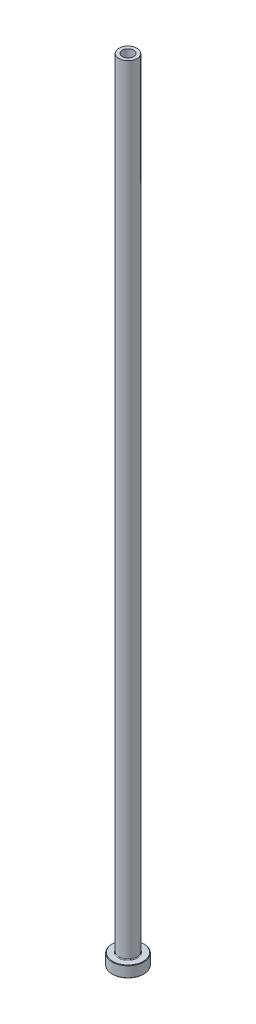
SolidWorks part; units mm, degrees
ref_plane "Front Plane" through (0, 0, 0) normal (0, 0, 1) x (1, 0, 0)
ref_plane "Top Plane" through (0, 0, 0) normal (0, 1, 0) x (1, 0, 0)
ref_plane "Right Plane" through (0, 0, 0) normal (1, 0, 0) x (0, 0, -1)
sketch "Sketch1" plane through (0, 0, 0) normal (0, 0, 1) x (1, 0, 0)
  line L0 (-2.5, 350) -> (-4, 350)
  line L1 (-4, 350) -> (-4, 5)
  line L2 (-4, 5) -> (-7, 5)
  line L3 (-7, 5) -> (-7, 0)
  line L4 (7.7, 0) -> (-7.7, 0) construction
  line L5 (-7, 0) -> (-2.75, 0)
  line L6 (-2.5, 305) -> (-2.5, 350)
  line L7 (0, 92.1877) -> (0, -15.5353) construction
  line L8 (0, -7.7) -> (0, 7.7) construction
  line L9 (-2.5, 305) -> (-2.75, 293)
  line L10 (-2.75, 293) -> (-2.75, 0)
  dimension "D1" = 0.25
  dimension "ID" = 5
  dimension "OD" = 8
  dimension "L" = 350
  dimension "H" = 14
  dimension "T" = 5
  dimension "N" = 45
  dimension "D2" = 12
revolve "Revolve1" add sketch "Sketch1" angle 360 about L7
fillet "Fillet1" radius 0.3 1 edges at (0, 5, 4)
chamfer "Chamfer1" distance 0.2 angle 45 2 edges at (0, 5, 7) (0, 0, 7)
chamfer "Chamfer3" distance 0.5 angle 45 1 edges at (0, 0, 2.75)
